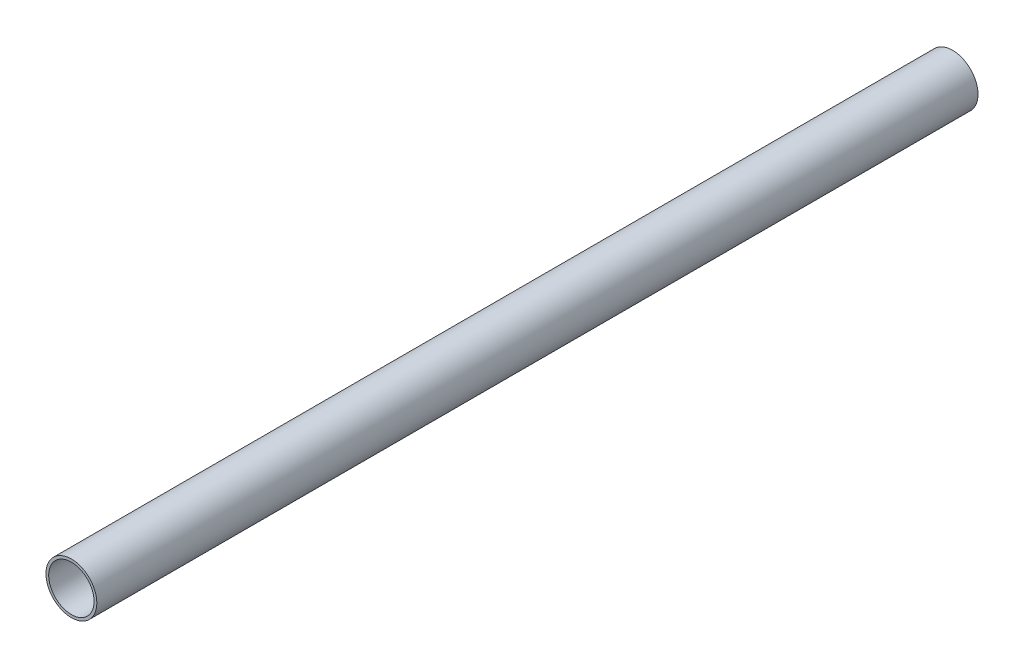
SolidWorks part; units mm, degrees
ref_plane "Plan de face" through (0, 0, 0) normal (0, 0, 1) x (1, 0, 0)
ref_plane "Plan de dessus" through (0, 0, 0) normal (0, 1, 0) x (1, 0, 0)
ref_plane "Plan de droite" through (0, 0, 0) normal (1, 0, 0) x (0, 0, -1)
sketch "Esquisse1" plane through (0, 0, 0) normal (0, 0, 1) x (1, 0, 0)
  circle A0 centre (0, 0) radius 12.5
  dimension "D1" = 25
extrude "Extru.-Mince1" add sketch "Esquisse1" along normal blind 485 thin
